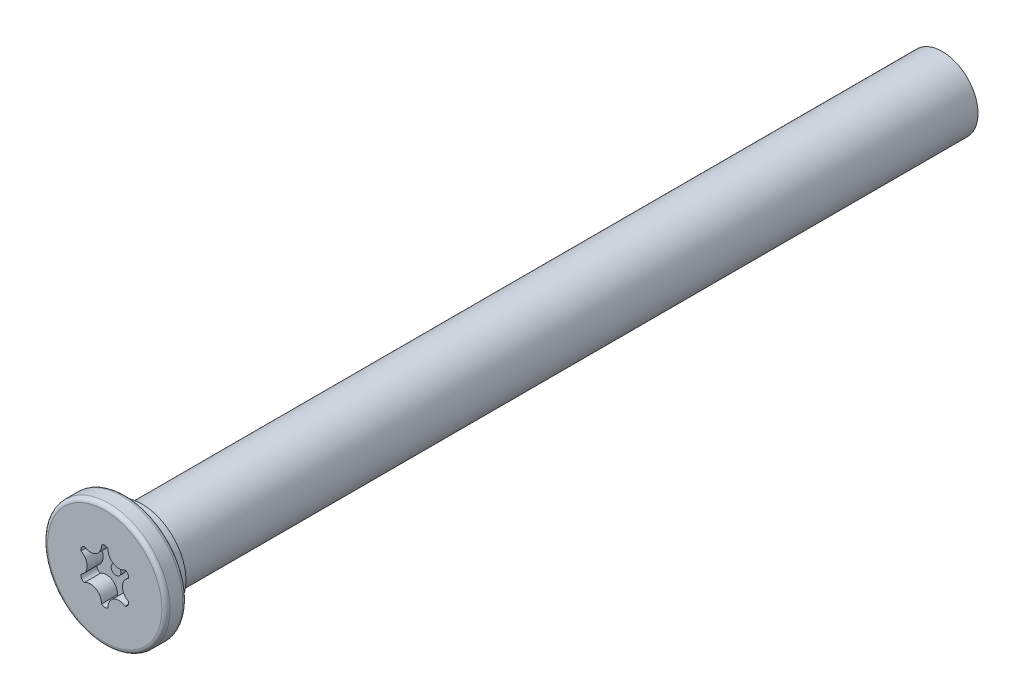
SolidWorks part; units mm, degrees
ref_plane "Front Plane" through (0, 0, 0) normal (0, 0, 1) x (1, 0, 0)
ref_plane "Top Plane" through (0, 0, 0) normal (0, 1, 0) x (1, 0, 0)
ref_plane "Right Plane" through (0, 0, 0) normal (1, 0, 0) x (0, 0, -1)
sketch "Sketch2" plane through (0, 0, 0) normal (1, 0, 0) x (0, 0, -1)
  line L1 (0, 0) -> (1.3, 0)
  line L2 (0, 0) -> (0, 3.81)
  line L3 (0, 3.81) -> (1.3, 3.81)
  line L4 (1.3, 0) -> (1.3, 3.81)
  line L5 (1.3, 0) -> (14, 0)
  line L6 (1.3, 0) -> (1.3, 2.23)
  line L7 (1.3, 2.23) -> (14, 2.23)
  line L8 (14, 0) -> (14, 2.23)
  dimension "D1" = 3.81
  dimension "D2" = 1.3
  dimension "D3" = 12.7
  dimension "D4" = 2.23
revolve "Revolve1" add sketch "Sketch2" angle 360 about L5
sketch "Sketch3" plane through (0, 0, 0) normal (0, 0, 1) x (1, 0, 0)
  line L0 (0, 1.3843) -> (0, 0)
  line L3 (1.1845, -1.0048) -> (2.4257, -1.0048)
  line L4 (0, 1.675) -> (0, 1.6727)
  line L5 (0, 1.675) -> (0, 1.6727)
  line L6 (0, 1.6727) -> (0, 1.675)
  line L8 (1.0407, 1.8026) -> (1.1012, 1.9073)
  line L9 (1.3857, 1.205) -> (2.5818, 1.205)
  line L10 (0, 0) -> (0.8375, 1.4506)
  line L11 (0, 0) -> (2.5818, 0)
  line L14 (2.5818, 0) -> (2.5818, 1.205)
  line L15 (1.3857, 1.205) -> (-0.1691, 1.205)
  circle A0 centre (0, 0) radius 1.675
  arc A7 (1.1845, -1.0048) -> (1.0345, -1.0748) centre (0.8546, -0.4934) cw
  arc A16 (-0.2051, 1.5894) -> (0.2051, 1.5894) centre (0, 1.3843) cw
  arc A18 (0.2051, 1.5894) -> (1.2739, 0.9723) centre (0.8938, 1.5482) ccw
  arc A19 (1.479, 0.6171) -> (1.479, -0.6171) centre (1.7877, 0) ccw
  arc A20 (1.2739, 0.9723) -> (1.479, 0.6171) centre (1.1988, 0.6922) cw
  arc A21 (1.2739, -0.9723) -> (0.2051, -1.5894) centre (0.8938, -1.5482) ccw
  arc A22 (1.479, -0.6171) -> (1.2739, -0.9723) centre (1.1988, -0.6922) cw
  arc A23 (-0.2051, -1.5894) -> (-1.2739, -0.9723) centre (-0.8938, -1.5482) ccw
  arc A24 (0.2051, -1.5894) -> (-0.2051, -1.5894) centre (0, -1.3843) cw
  arc A25 (-1.479, -0.6171) -> (-1.479, 0.6171) centre (-1.7877, 0) ccw
  arc A26 (-1.2739, -0.9723) -> (-1.479, -0.6171) centre (-1.1988, -0.6922) cw
  arc A27 (-1.2739, 0.9723) -> (-0.2051, 1.5894) centre (-0.8938, 1.5482) ccw
  arc A28 (-1.479, 0.6171) -> (-1.2739, 0.9723) centre (-1.1988, 0.6922) cw
  point P38 (0, 0)
  point P52 (0, 0)
  dimension "D1" = 3.35
  dimension "D4" = 1.205
  dimension "D2" = 6
  dimension "D5" = 60
extrude "Cut-Extrude3" cut sketch "Sketch3" against normal blind 1
fillet "Fillet12" radius 0.254 2 edges at (3.81, 0, 0) (3.81, 0, -1.3)
sketch "Sketch7" plane through (0, 0, -14) normal (0, 0, -1) x (-1, 0, 0)
  circle A0 centre (0, 0) radius 2.23
  dimension "D1" = 4.46
extrude "Cut-Extrude6" cut sketch "Sketch7" against normal blind 12.7
sketch "Sketch11" plane through (0, 0, -1.3) normal (0, 0, -1) x (-1, 0, 0)
  circle A0 centre (0, 0) radius 2.23
  circle A1 centre (0, 0) radius 2.738
extrude "Boss-Extrude1" add sketch "Sketch11" along normal blind 1.016
sketch "Sketch12" plane through (0, 0, -1.3) normal (0, 0, -1) x (-1, 0, 0)
  circle A0 centre (0, 0) radius 2.23
extrude "Boss-Extrude2" add sketch "Sketch12" along normal blind 12.7
sketch "Sketch14" plane through (0, 0, -1) normal (0, 0, 1) x (1, 0, 0)
  circle A0 centre (0, 0) radius 0.3
extrude "Boss-Extrude4" add sketch "Sketch14" along normal blind 0.3
sketch "Sketch15" plane through (0, 0, -14) normal (0, 0, -1) x (-1, 0, 0)
  circle A0 centre (0, 0) radius 2.23
extrude "Cut-Extrude7" cut sketch "Sketch15" against normal blind 12.7
sketch "Sketch16" plane through (0, 0, -1.3) normal (0, 0, -1) x (-1, 0, 0)
  circle A0 centre (0, 0) radius 2.23
extrude "Boss-Extrude5" add sketch "Sketch16" along normal blind 50.8
